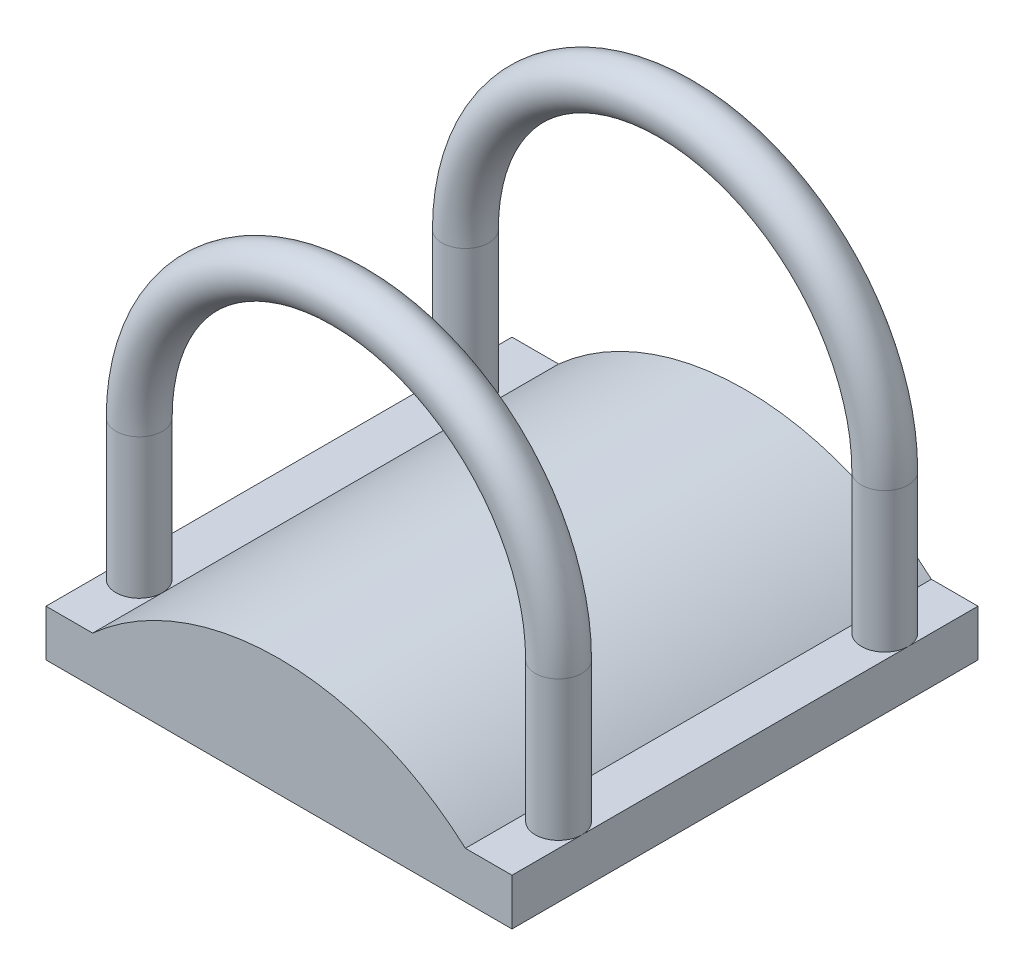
SolidWorks part; units mm, degrees
ref_plane "Front Plane" through (0, 0, 0) normal (0, 0, 1) x (1, 0, 0)
ref_plane "Top Plane" through (0, 0, 0) normal (0, 1, 0) x (1, 0, 0)
ref_plane "Right Plane" through (0, 0, 0) normal (1, 0, 0) x (0, 0, -1)
sketch "Sketch1" plane through (0, 0, 0) normal (0, 0, 1) x (1, 0, 0)
  line L0 (0, 0) -> (-100, 0)
  line L1 (-100, 0) -> (-100, 10)
  line L2 (-100, 10) -> (-90, 10)
  line L3 (0, 10) -> (0, 0)
  line L4 (0, 10) -> (-10, 10)
  arc A0 (-90, 10) -> (-10, 10) centre (-50, -34.7214) cw
  dimension "D4" = 60
  dimension "D1" = 10
  dimension "D2" = 100
  dimension "D3" = 10
extrude "Extrude1" add sketch "Sketch1" along normal mid plane 100
sketch "Sketch2" plane through (0, 0, 0) normal (0, 0, 1) x (1, 0, 0)
  line L0 (-95, 10) -> (-95, 40)
  line L1 (-90, 10) -> (-100, 10) construction
  line L2 (-5, 40) -> (-5, 10)
  line L3 (0, 10) -> (-10, 10) construction
  arc A0 (-95, 40) -> (-5, 40) centre (-50, 40) cw
  dimension "D1" = 30
sketch "Sketch3" plane through (0, 10, 0) normal (0, 1, 0) x (-1, 0, 0)
  line L0 (5, 0) -> (-15.6242, 0) construction
  line L1 (95, 0) -> (5, 0) construction
  line L2 (5, 35) -> (5, 50) construction
  line L3 (0, 50) -> (10, 50) construction
  circle A0 centre (5, 35) radius 5
  circle A1 centre (5, -35) radius 5
  dimension "D1" = 10
  dimension "D2" = 15
sweep "Sweep1" add profiles "Sketch3" path "Sketch2"
